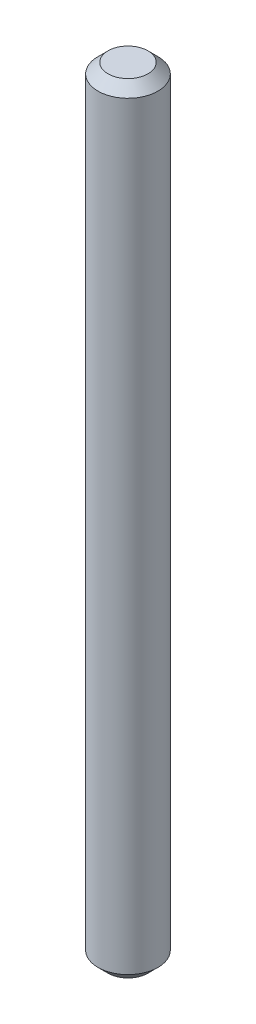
SolidWorks part; units mm, degrees
ref_plane "Plan de face" through (0, 0, 0) normal (0, 0, 1) x (1, 0, 0)
ref_plane "Plan de dessus" through (0, 0, 0) normal (0, 1, 0) x (1, 0, 0)
ref_plane "Plan de droite" through (0, 0, 0) normal (1, 0, 0) x (0, 0, -1)
sketch "Esquisse1" plane through (0, 0, 0) normal (0, 1, 0) x (1, 0, 0)
  circle A0 centre (0, 0) radius 3
  dimension "D1" = 6
extrude "Extrusion1" add sketch "Esquisse1" along normal mid plane 78
chamfer "Chanfrein1" distance 1 angle 45 2 edges at (0, -39, 3) (0, 39, 3)
